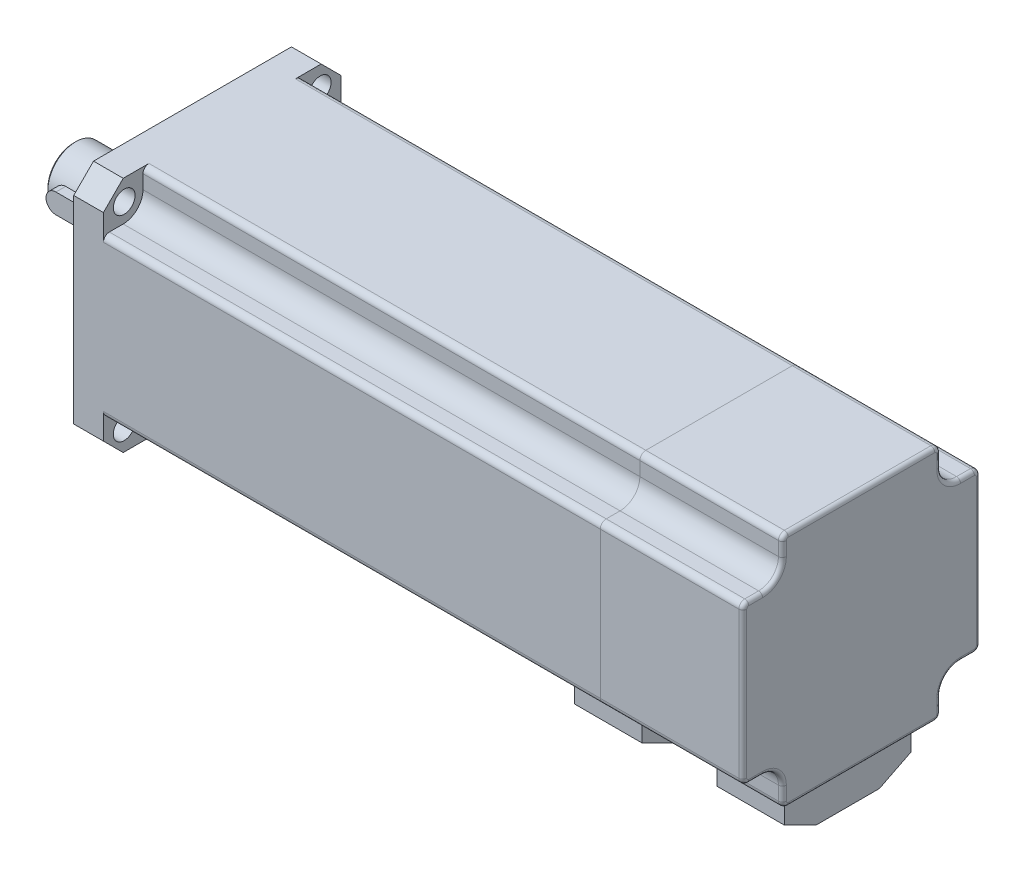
SolidWorks part; units mm, degrees
ref_plane "前视基准面" through (0, 0, 0) normal (0, 0, 1) x (1, 0, 0)
ref_plane "上视基准面" through (0, 0, 0) normal (0, 1, 0) x (1, 0, 0)
ref_plane "右视基准面" through (0, 0, 0) normal (1, 0, 0) x (0, 0, -1)
sketch "草图1" plane through (0, 0, 0) normal (1, 0, 0) x (0, 0, -1)
  line L0 (-30, 25) -> (-25, 30)
  line L1 (-25, -30) -> (25, -30)
  line L2 (-30, -25) -> (-30, 25)
  line L3 (-25, 30) -> (25, 30)
  line L4 (30, -25) -> (30, 25)
  line L5 (-30, -30) -> (30, 30) construction
  line L6 (-30, 30) -> (30, -30) construction
  line L7 (25, 30) -> (30, 25)
  line L8 (25, -30) -> (30, -25)
  line L9 (-30, -25) -> (-25, -30)
  point P0 (0, 0)
extrude "凸台-拉伸1" add sketch "草图1" along normal blind 133
sketch "草图2" plane through (133, 0, 0) normal (1, 0, 0) x (0, 0, -1)
  line L0 (25, 30) -> (-25, 30) construction
  line L1 (-25, -30) -> (25, -30)
  line L2 (-30, -25) -> (-30, 25)
  line L3 (-25, 30) -> (25, 30)
  line L4 (30, -25) -> (30, 25)
  line L5 (-30, -30) -> (30, 30) construction
  line L6 (-30, 30) -> (30, -30) construction
  line L7 (-30, 25) -> (-25, 30)
  line L8 (-30, -25) -> (-25, -30)
  line L9 (25, -30) -> (30, -25)
  line L10 (25, 30) -> (30, 25)
  point P0 (0, 0)
extrude "凸台-拉伸2" add sketch "草图2" along normal blind 36 separate body
sketch "草图3" plane through (169, 0, 0) normal (1, 0, 0) x (0, 0, -1)
  line L0 (-25, 20) -> (-28.5, 20)
  line L1 (-30, 18.5) -> (-30, 25)
  line L2 (-30, 25) -> (-25, 30)
  line L3 (-25, 30) -> (-18.5, 30)
  line L4 (18.5, 30) -> (25, 30)
  line L5 (25, 30) -> (30, 25)
  line L6 (30, 25) -> (30, 18.5)
  line L7 (-30, 25) -> (-30, -25) construction
  line L9 (-28.5, -20) -> (-25, -20)
  line L10 (30, -18.5) -> (30, -25)
  line L11 (-20, -25) -> (-20, -28.5)
  line L12 (-25, -30) -> (25, -30) construction
  line L14 (20, -28.5) -> (20, -25)
  line L15 (30, -25) -> (25, -30)
  line L16 (25, -20) -> (28.5, -20)
  line L17 (30, -25) -> (30, 25) construction
  line L19 (28.5, 20) -> (25, 20)
  line L20 (25, -30) -> (18.5, -30)
  line L21 (20, 25) -> (20, 28.5)
  line L23 (-18.5, -30) -> (-25, -30)
  line L24 (-20, 25) -> (-20, 28.5)
  line L25 (25, 30) -> (-25, 30) construction
  line L27 (-25, -30) -> (-30, -25)
  line L28 (-30, -25) -> (-30, -18.5)
  arc A0 (-25, 20) -> (-20, 25) centre (-25, 25) ccw
  arc A1 (20, 25) -> (25, 20) centre (25, 25) ccw
  arc A2 (25, -20) -> (20, -25) centre (25, -25) ccw
  arc A3 (-20, -25) -> (-25, -20) centre (-25, -25) ccw
  arc A4 (-30, -18.5) -> (-28.5, -20) centre (-28.5, -18.5) ccw
  arc A5 (-20, -28.5) -> (-18.5, -30) centre (-18.5, -28.5) ccw
  arc A6 (18.5, -30) -> (20, -28.5) centre (18.5, -28.5) ccw
  arc A7 (28.5, -20) -> (30, -18.5) centre (28.5, -18.5) ccw
  arc A8 (30, 18.5) -> (28.5, 20) centre (28.5, 18.5) ccw
  arc A9 (20, 28.5) -> (18.5, 30) centre (18.5, 28.5) ccw
  arc A10 (-20, 28.5) -> (-18.5, 30) centre (-18.5, 28.5) cw
  arc A11 (-28.5, 20) -> (-30, 18.5) centre (-28.5, 18.5) ccw
  point P0 (0, 0)
  point P10 (-30, -20)
  point P39 (-20, -30)
  point P42 (20, -30)
  point P45 (30, -20)
  point P48 (30, 20)
  point P53 (-20, 30)
  point P56 (-30, 20)
  dimension "D1" = 1.5
extrude "切除-拉伸1" cut sketch "草图3" against normal blind 161.5
fillet "圆角1" radius 1 24 edges at (169, 19.5607, 29.5607) (169, 20, 26.75) (169, 21.4645, 21.4645) (169, 26.75, 20) (169, 29.5607, 19.5607) (169, 30, 0) (169, 29.5607, -19.5607) (169, 26.75, -20) (169, 21.4645, -21.4645) (169, 20, -26.75) (169, 19.5607, -29.5607) (169, 0, -30) (169, -19.5607, -29.5607) (169, -20, -26.75) (169, -21.4645, -21.4645) (169, -26.75, -20) (169, -29.5607, -19.5607) (169, -30, 0) (169, -29.5607, 19.5607) (169, -26.75, 20) (169, -21.4645, 21.4645) (169, -20, 26.75) (169, -19.5607, 29.5607) (169, 0, 30)
sketch "草图4" plane through (0, 0, 0) normal (-1, 0, 0) x (0, 0, 1)
  circle A1 centre (-24.7487, 24.7487) radius 2.75
  circle A2 centre (24.7487, 24.7487) radius 2.75
  circle A3 centre (-24.7487, -24.7487) radius 2.75
  circle A4 centre (24.7487, -24.7487) radius 2.75
extrude "切除-拉伸2" cut sketch "草图4" against normal blind 7.5
sketch "草图5" plane through (0, 0, 0) normal (-1, 0, 0) x (0, 0, 1)
  circle A0 centre (0, 0) radius 25
  circle A1 centre (0, 0) radius 22.5
extrude "凸台-拉伸3" add sketch "草图5" along normal blind 3 separate body
sketch "草图6" plane through (0, 0, 0) normal (-1, 0, 0) x (0, 0, 1)
  circle A0 centre (0, 0) radius 7.5
extrude "凸台-拉伸4" add sketch "草图6" along normal blind 5
fillet "圆角2" radius 0.5 1 edges at (-5, 0, 7.5)
sketch "草图7" plane through (-5, 0, 0) normal (-1, 0, 0) x (0, 0, 1)
  circle A0 centre (0, 0) radius 7
  point P3 (0, 0)
extrude "凸台-拉伸5" add sketch "草图7" along normal blind 25
chamfer "倒角1" distance 0.5 angle 45 1 edges at (-30, 0, 7)
ref_plane "基准面1" through (0, 0, 7) normal (0, 0, 1) x (1, 0, 0)
sketch "草图8" plane through (0, 0, 7) normal (0, 0, 1) x (1, 0, 0)
  line L3 (-25.5, 2.5) -> (-10, 2.5)
  line L5 (-10, -2.5) -> (-25.5, -2.5)
  arc A0 (-25.5, 2.5) -> (-25.5, -2.5) centre (-25.5, 0) ccw
  arc A1 (-10, -2.5) -> (-10, 2.5) centre (-10, 0) ccw
extrude "切除-拉伸3" cut sketch "草图8" against normal blind 3
sketch "草图9" plane through (0, 0, 4) normal (0, 0, 1) x (1, 0, 0)
  line L0 (-25.5, 2.5) -> (-10, 2.5)
  line L2 (-10, -2.5) -> (-25.5, -2.5)
  arc A0 (-25.5, 2.5) -> (-25.5, -2.5) centre (-25.5, 0) ccw
  arc A1 (-10, -2.5) -> (-10, 2.5) centre (-10, 0) ccw
extrude "凸台-拉伸6" add sketch "草图9" along normal blind 5 separate body
sketch "草图10" plane through (0, -30, 0) normal (0, -1, 0) x (-1, 0, 0)
  line L11 (-148.5, 16) -> (-165.5, 16)
  line L12 (-148.5, 16) -> (-148.5, -16)
  line L13 (-148.5, -16) -> (-165.5, -16)
  line L14 (-165.5, 16) -> (-165.5, -16)
  line L15 (-148.5, 16) -> (-165.5, -16) construction
  line L16 (-148.5, -16) -> (-165.5, 16) construction
  line L19 (-112.5, 16) -> (-129.5, 16)
  line L20 (-112.5, 16) -> (-112.5, -16)
  line L21 (-112.5, -16) -> (-129.5, -16)
  line L22 (-129.5, 16) -> (-129.5, -16)
  line L25 (-112.5, 16) -> (-129.5, -16) construction
  line L26 (-112.5, -16) -> (-129.5, 16) construction
extrude "凸台-拉伸7" add sketch "草图10" along normal blind 11 separate body
sketch "草图15" plane through (112.5, 0, 0) normal (-1, 0, 0) x (0, 0, 1)
  line L0 (-16, -41) -> (-16, -37)
  line L1 (-16, -41) -> (-16, -30) construction
  line L2 (-16, -41) -> (-8, -41)
  line L3 (-16, -37) -> (-8, -41)
  line L4 (16, -41) -> (8, -41)
  line L5 (16, -41) -> (-16, -41) construction
  line L6 (16, -41) -> (16, -37)
  line L7 (16, -41) -> (16, -30) construction
  line L8 (16, -37) -> (8, -41)
extrude "切除-拉伸6" cut sketch "草图15" against normal blind 53
